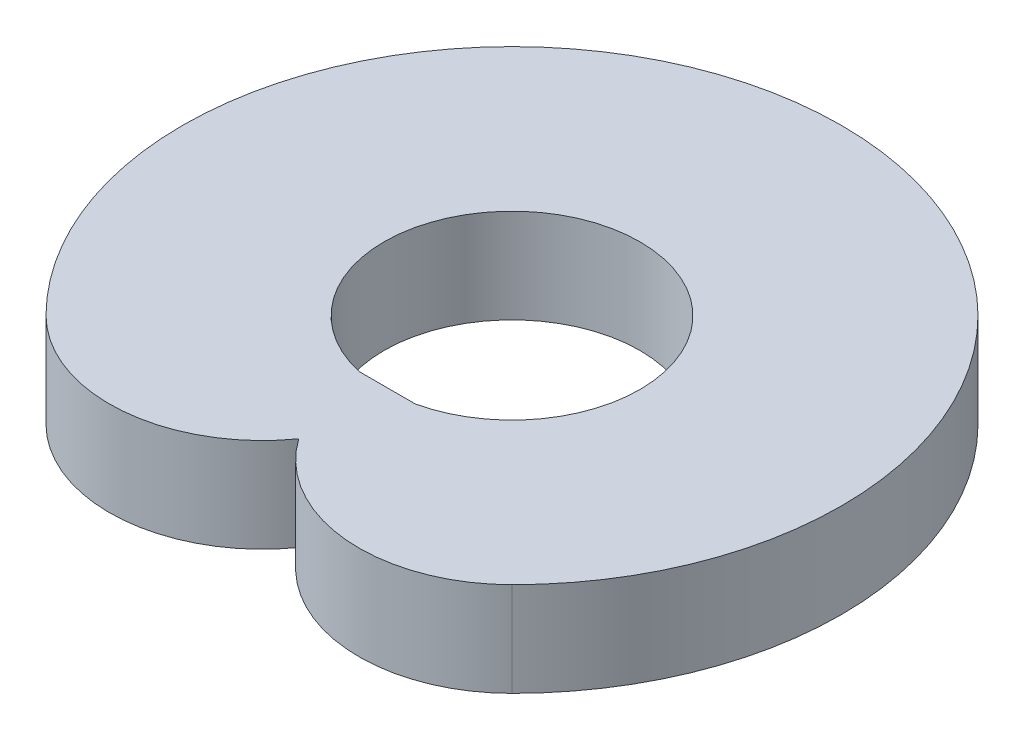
SolidWorks part; units mm, degrees
ref_plane "前视基准面" through (0, 0, 0) normal (0, 0, 1) x (1, 0, 0)
ref_plane "上视基准面" through (0, 0, 0) normal (0, 1, 0) x (1, 0, 0)
ref_plane "右视基准面" through (0, 0, 0) normal (1, 0, 0) x (0, 0, -1)
sketch "草图1" plane through (0, 0, 0) normal (0, 1, 0) x (1, 0, 0)
  line L0 (0, 0) -> (0, 825) construction
  line L1 (0, 0) -> (-494.9747, -494.9747) construction
  line L2 (0, 0) -> (494.9747, -494.9747) construction
  line L3 (0, 375) -> (229.8097, 145.1903) construction
  line L4 (0, 375) -> (-229.8097, 145.1903) construction
  line L5 (59.835, -265.165) -> (-59.835, -265.165)
  circle A0 centre (0, 0) radius 375 construction
  circle A1 centre (0, 375) radius 325 construction
  arc A2 (494.9747, -494.9747) -> (-494.9747, -494.9747) centre (0, 0) ccw
  arc A4 (-494.9747, -494.9747) -> (0, -453.0812) centre (-265.165, -265.165) ccw
  arc A5 (0, -453.0812) -> (494.9747, -494.9747) centre (265.165, -265.165) ccw
  arc A7 (59.835, -265.165) -> (-59.835, -265.165) centre (0, 0) ccw
  point P19 (0, -299)
  dimension "D1" = 750
  dimension "D2" = 650
  dimension "D4" = 135
  dimension "D3" = 700
  dimension "D8" = 325
  dimension "D5" = 135
  dimension "D6" = 135
  dimension "D7" = 135
  dimension "D9" = 135
extrude "凸台-拉伸1" add sketch "草图1" along normal blind 200
